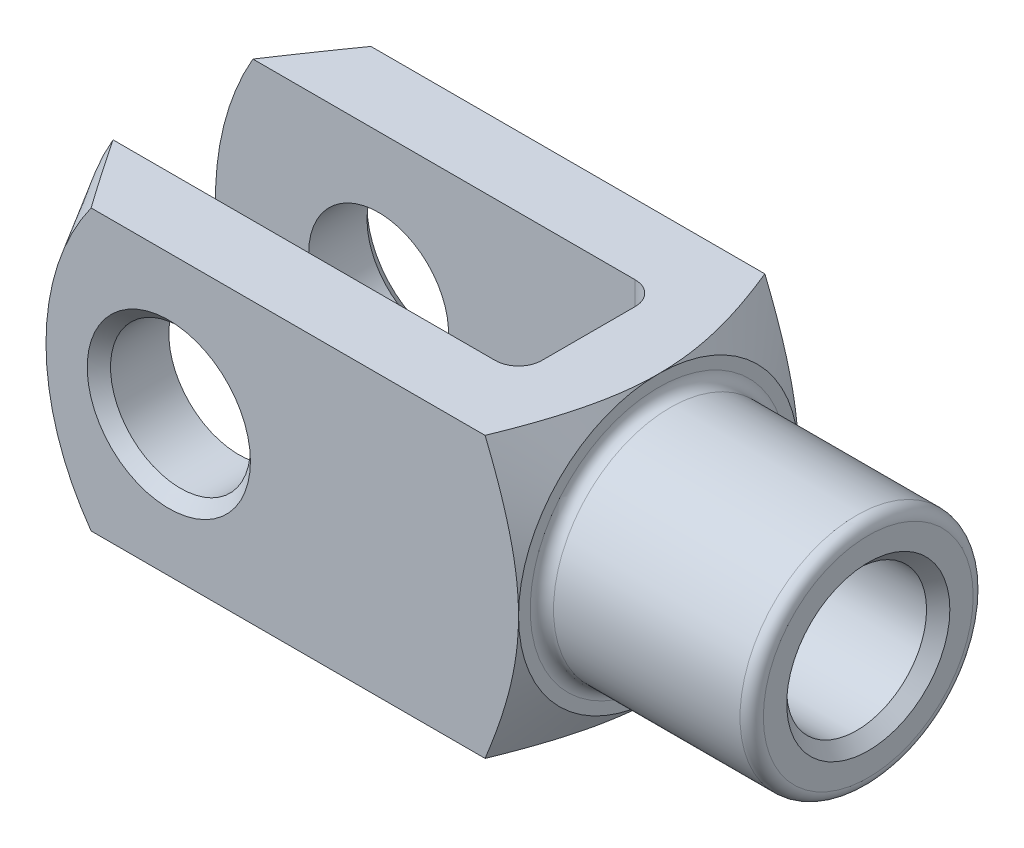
SolidWorks part; units mm, degrees
ref_plane "Front Plane" through (0, 0, 0) normal (0, 0, 1) x (1, 0, 0)
ref_plane "Top Plane" through (0, 0, 0) normal (0, 1, 0) x (1, 0, 0)
ref_plane "Right Plane" through (0, 0, 0) normal (1, 0, 0) x (0, 0, -1)
sketch "Sketch1" plane through (0, 0, 0) normal (1, 0, 0) x (0, 0, -1)
  line L0 (0, 0) -> (0, 50000) construction
  line L1 (0, 0) -> (50000, 0) construction
  line L2 (-6, -6) -> (-6, 6)
  line L3 (-6, 6) -> (6, 6)
  line L4 (6, -6) -> (6, 6)
  line L5 (-6, -6) -> (6, -6)
  point P9 (0, 6)
  point P11 (6, 0)
  point P12 (-6, 0)
  dimension "D1" = 12
  dimension "D2" = 12
extrude "Extrude1" add sketch "Sketch1" against normal blind 31
sketch "Sketch2" plane through (0, 0, 0) normal (1, 0, 0) x (0, 0, -1)
  circle A0 centre (0, 0) radius 5
  circle A1 centre (0, 0) radius 10
  dimension "D1" = 10
  dimension "D2" = 20
extrude "Extrude2" cut sketch "Sketch2" against normal blind 9
sketch "Sketch3" plane through (0, 0, 6) normal (0, 0, 1) x (1, 0, 0)
  circle A0 centre (-24, 0) radius 3
  dimension "D1" = 6
  dimension "D2" = 24
extrude "Extrude3" cut sketch "Sketch3" against normal through all
sketch "Sketch4" plane through (0, 6, 0) normal (0, 1, 0) x (1, 0, 0)
  line L0 (0, 0) -> (-50000, 0) construction
  line L1 (-31, -3) -> (-31, 3)
  line L2 (-31, 6) -> (-31, -6) construction
  line L3 (-31, 3) -> (-12, 3)
  line L4 (-12, 3) -> (-12, -3)
  line L5 (-24, 6) -> (-24, -6) construction
  line L6 (-31, -3) -> (-12, -3)
  point P7 (-24, 0)
  point P13 (-12, 0)
  point P14 (-31, 0)
  dimension "D1" = 12
  dimension "D2" = 6
extrude "Extrude4" cut sketch "Sketch4" against normal through all
fillet "Fillet1" radius 1 2 edges at (-12, 0, 3) (-12, 0, -3)
fillet "Fillet2" radius 0.5 2 edges at (0, 0, -5) (-9, 0, -5)
chamfer "Chamfer2" distance 0.5 angle 45 2 edges at (-21, 0, -6) (-21, 0, 6)
sketch "Sketch6" plane through (0, 0, 0) normal (0, 0, 1) x (1, 0, 0)
  line L0 (-9, -6) -> (-9, -12)
  line L1 (-9, -12) -> (-12.4641, -12)
  line L2 (-12.4641, -12) -> (-9, -6)
  dimension "D1" = 30
  dimension "D2" = 12
revolve "Cut-Revolve1" cut sketch "Sketch6" angle 360 about axis through (-9, 0, 0) along (1, 0, 0)
sketch "Sketch7" plane through (0, 0, 0) normal (0, 1, 0) x (1, 0, 0)
  line L0 (-29.2679, -6) -> (-31, -3)
  line L1 (-31, 3) -> (-29.2679, 6)
  line L2 (-29.2679, 6) -> (-43, 6)
  line L3 (-31, 3) -> (-31, -3)
  line L4 (-43, 6) -> (-43, -6)
  line L5 (-43, -6) -> (-29.2679, -6)
  line L6 (-31, 6) -> (-10.4349, 6) construction
  line L7 (-31, -6) -> (-10.4349, -6) construction
  line L8 (-19, 0.6162) -> (-19, 50000.6162) construction
  dimension "D1" = 120
  dimension "D2" = 12
  dimension "D3" = 12
revolve "Cut-Revolve2" cut sketch "Sketch7" angle 180 about L8
sketch "Sketch8" plane through (0, 0, 0) normal (1, 0, 0) x (0, 0, -1)
  circle A0 centre (0, 0) radius 3
  dimension "D1" = 6
extrude "Extrude5" cut sketch "Sketch8" against normal through all
chamfer "Chamfer3" distance 0.5 angle 45 1 edges at (0, 0, -3)
equation "\"D2@Sketch1\" = \"D1@Sketch1\""
equation "\"D2@Sketch2\" = \"D1@Sketch2\"*2"
equation "\"D2@Sketch6\" = \"D1@Sketch1\""
equation "\"D2@Sketch7\" = \"D1@Sketch1\""
equation "\"D3@Sketch7\" = \"D1@Sketch1\""
